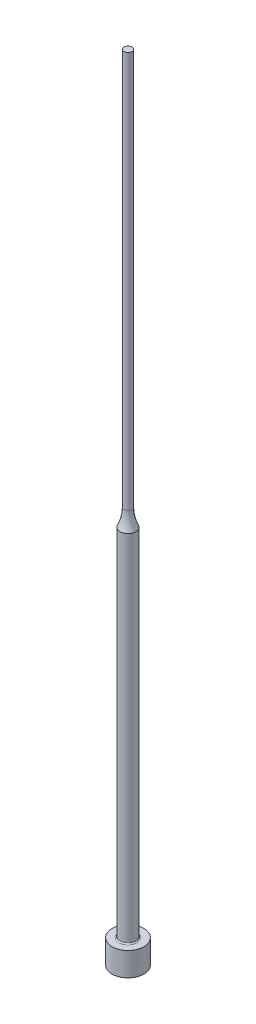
SolidWorks part; units mm, degrees
ref_plane "Front Plane" through (0, 0, 0) normal (0, 0, 1) x (1, 0, 0)
ref_plane "Top Plane" through (0, 0, 0) normal (0, 1, 0) x (1, 0, 0)
ref_plane "Right Plane" through (0, 0, 0) normal (1, 0, 0) x (0, 0, -1)
sketch "Sketch1" plane through (0, 0, 0) normal (0, 0, 1) x (1, 0, 0)
  line L0 (0, 0) -> (4, 0)
  line L1 (55, 0) -> (-55, 0) construction
  line L2 (4, 0) -> (4, 6)
  line L3 (4, 6) -> (2.3, 6)
  line L4 (2, 6.3) -> (2, 95.6411)
  line L6 (1, 100) -> (1, 200)
  line L7 (1, 200) -> (0, 200)
  line L8 (0, 200) -> (0, 0)
  arc A0 (1, 100) -> (2, 95.6411) centre (11, 100) ccw
  arc A1 (2.3, 6) -> (2, 6.3) centre (2.3, 6.3) cw
  dimension "D7" = 100
  dimension "D8" = 0.3
  dimension "D5" = 10
  dimension "D1" = 1
  dimension "D2" = 2
  dimension "D3" = 4
  dimension "D4" = 6
  dimension "D6" = 200
revolve "Revolve1" add sketch "Sketch1" angle 360 about L8
